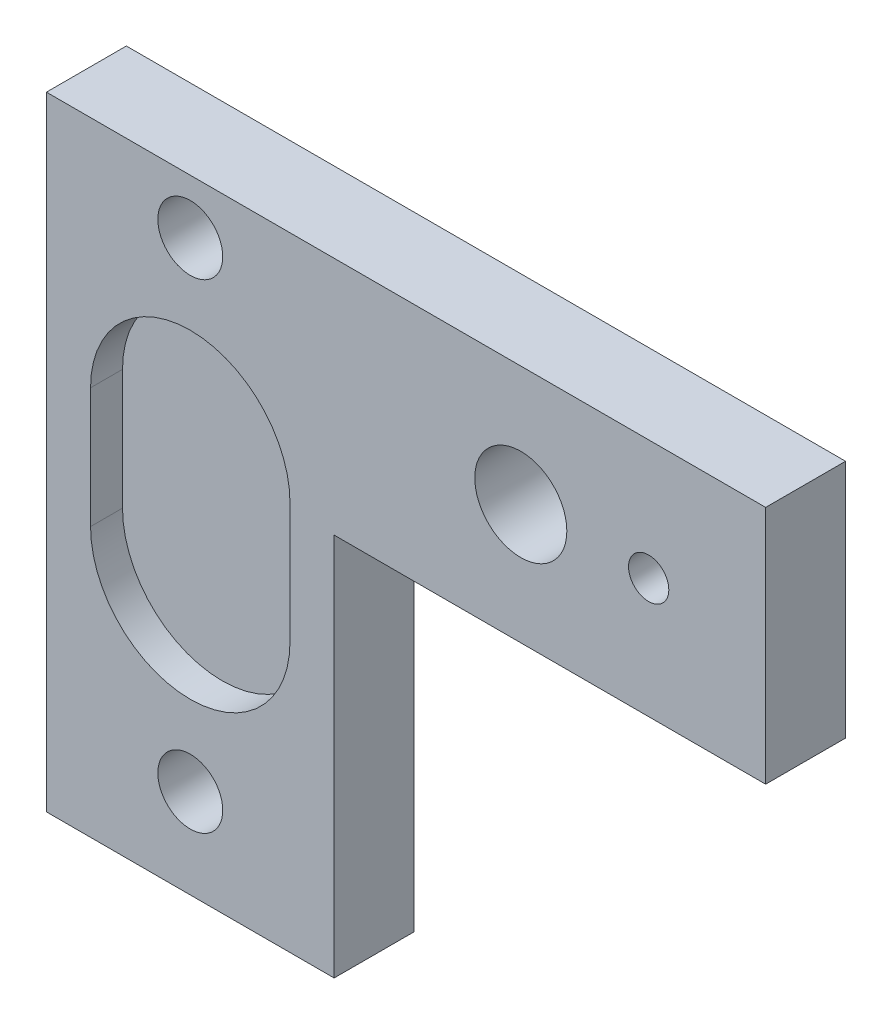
SolidWorks part; units mm, degrees
ref_plane "Front Plane" through (0, 0, 0) normal (0, 0, 1) x (1, 0, 0)
ref_plane "Top Plane" through (0, 0, 0) normal (0, 1, 0) x (1, 0, 0)
ref_plane "Right Plane" through (0, 0, 0) normal (1, 0, 0) x (0, 0, -1)
sketch "Sketch1" plane through (0, 0, 0) normal (0, 0, 1) x (1, 0, 0)
  line L0 (0, 0) -> (28.575, 0)
  line L1 (28.575, 0) -> (28.575, -9.525)
  line L2 (28.575, -9.525) -> (11.43, -9.525)
  line L3 (11.43, -9.525) -> (11.43, -24.765)
  line L4 (11.43, -24.765) -> (0, -24.765)
  line L5 (0, -24.765) -> (0, 0)
  circle A0 centre (23.9268, -4.7625) radius 0.8001
  dimension "D7" = 1.6002
  dimension "D1" = 28.575
  dimension "D2" = 9.525
  dimension "D3" = 24.765
  dimension "D4" = 11.43
  dimension "D5" = 4.7625
  dimension "D6" = 23.9268
extrude "Extrude1" add sketch "Sketch1" along normal blind 3.175
hole_wizard "#5-40 Tapped Hole1" positions "3DSketch1" profile "Sketch2" tap size "#5-40" standard "Ansi Inch"
sketch3d "3DSketch1"
  line L0 (0, 0, 3.175) -> (0, -24.765, 3.175) construction
  line L1 (28.575, 0, 3.175) -> (0, 0, 3.175) construction
  point P0 (5.715, -2.159, 3.175)
  point P7 (5.715, -21.209, 3.175)
  dimension "D1" = 5.715
  dimension "D2" = 2.159
  dimension "D3" = 5.715
  dimension "D4" = 19.05
sketch "Sketch2" plane through (5.715, -2.159, 3.175) normal (1, 0, 0) x (0, -1, 0)
  line L0 (0, 0) -> (0, 10.2995)
  line L1 (0, 10.2995) -> (1.289, 9.525)
  line L2 (1.289, 9.525) -> (1.289, 0)
  line L5 (1.289, 0) -> (0, 0)
  line L10 (0, 10.2995) -> (-1.2891, 9.525) construction
  line L11 (0, -6.35) -> (0, 107.95) construction
  dimension "Tap Drill Dia." = 2.5781
  dimension "Tap Drill Depth" = 9.525
  dimension "Drill Angle" = 118
hole_wizard "#6 Clearance Hole1" positions "3DSketch2" profile "Sketch3" hole size "#6" standard "Ansi Inch"
sketch3d "3DSketch2"
  line L0 (0, 0, 3.175) -> (0, -24.765, 3.175) construction
  line L1 (28.575, 0, 3.175) -> (0, 0, 3.175) construction
  point P0 (18.8468, -4.7625, 3.175)
  dimension "D1" = 18.8468
  dimension "D2" = 4.7625
sketch "Sketch3" plane through (18.8468, -4.7625, 3.175) normal (1, 0, 0) x (0, -1, 0)
  line L0 (0, 0) -> (0, 18.8789)
  line L1 (0, 18.8789) -> (1.8288, 17.78)
  line L2 (1.8288, 17.78) -> (1.8288, 0)
  line L5 (1.8288, 0) -> (0, 0)
  line L10 (0, 18.8789) -> (-1.8288, 17.78) construction
  line L11 (0, -6.35) -> (0, 107.95) construction
  dimension "Hole Dia." = 3.6576
  dimension "Hole Depth" = 17.78
  dimension "Drill Angle" = 118
sketch "Sketch4" plane through (0, 0, 3.175) normal (0, 0, 1) x (1, 0, 0)
  line L0 (1.7526, -9.2964) -> (1.7526, -14.0716)
  line L1 (9.6774, -9.2964) -> (9.6774, -14.0716)
  line L2 (0, 0) -> (0, -24.765) construction
  line L3 (9.6774, -11.684) -> (1.7526, -11.684) construction
  line L4 (5.715, -2.159) -> (5.715, -21.209) construction
  arc A0 (9.6774, -9.2964) -> (1.7526, -9.2964) centre (5.715, -9.2964) ccw
  arc A1 (1.7526, -14.0716) -> (9.6774, -14.0716) centre (5.715, -14.0716) ccw
  point P15 (5.715, -11.684)
  dimension "D1" = 7.9248
  dimension "D2" = 5.715
  dimension "D3" = 4.7752
extrude "Extrude2" cut sketch "Sketch4" against normal blind 1.27
